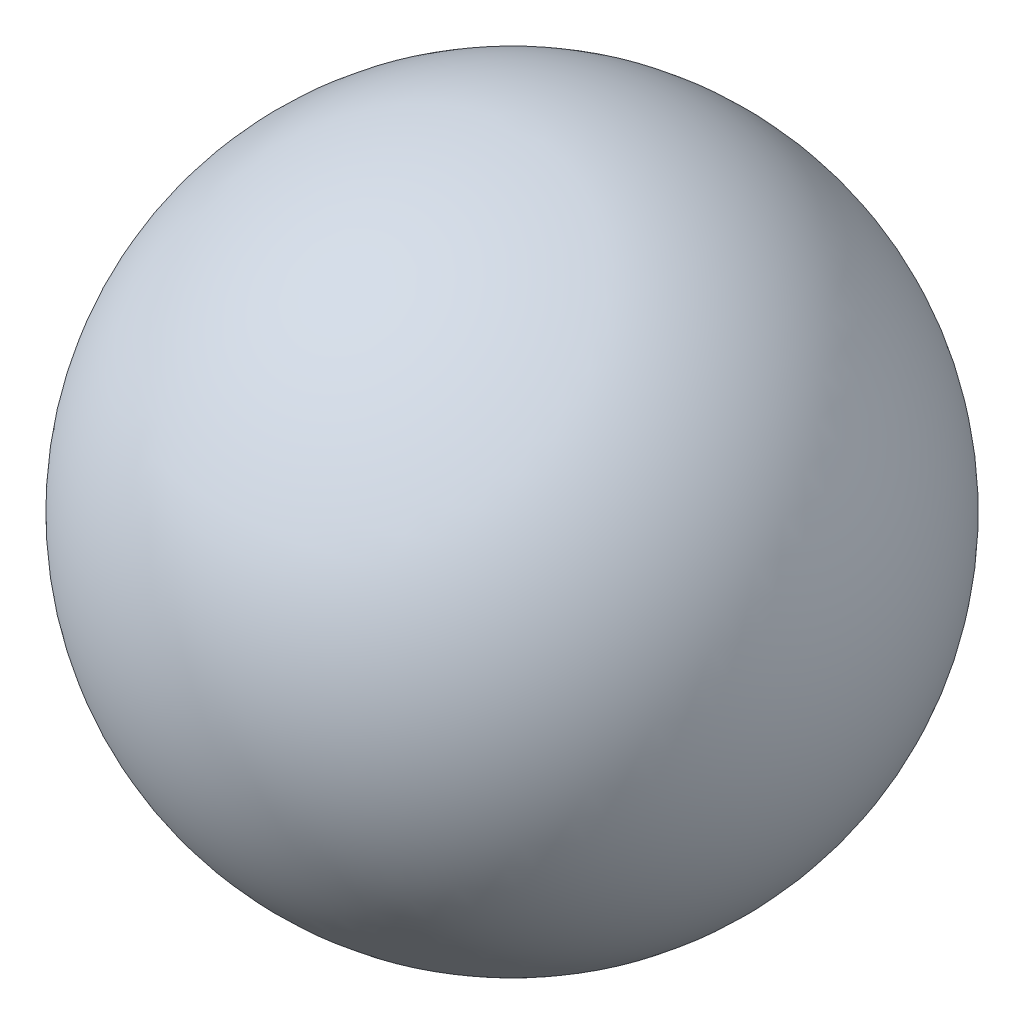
SolidWorks part; units mm, degrees
ref_plane "Front" through (0, 0, 0) normal (0, 0, 1) x (1, 0, 0)
ref_plane "Top" through (0, 0, 0) normal (0, 1, 0) x (1, 0, 0)
ref_plane "Right" through (0, 0, 0) normal (1, 0, 0) x (0, 0, -1)
sketch "草图1" plane through (0, 0, 0) normal (0, 0, 1) x (1, 0, 0)
  line L0 (0, 8.5) -> (0, -8.5)
  arc A0 (0, -8.5) -> (0, 8.5) centre (0, 0) ccw
  dimension "D1" = 17
revolve "旋转5" add sketch "草图1" angle 360 about L0
